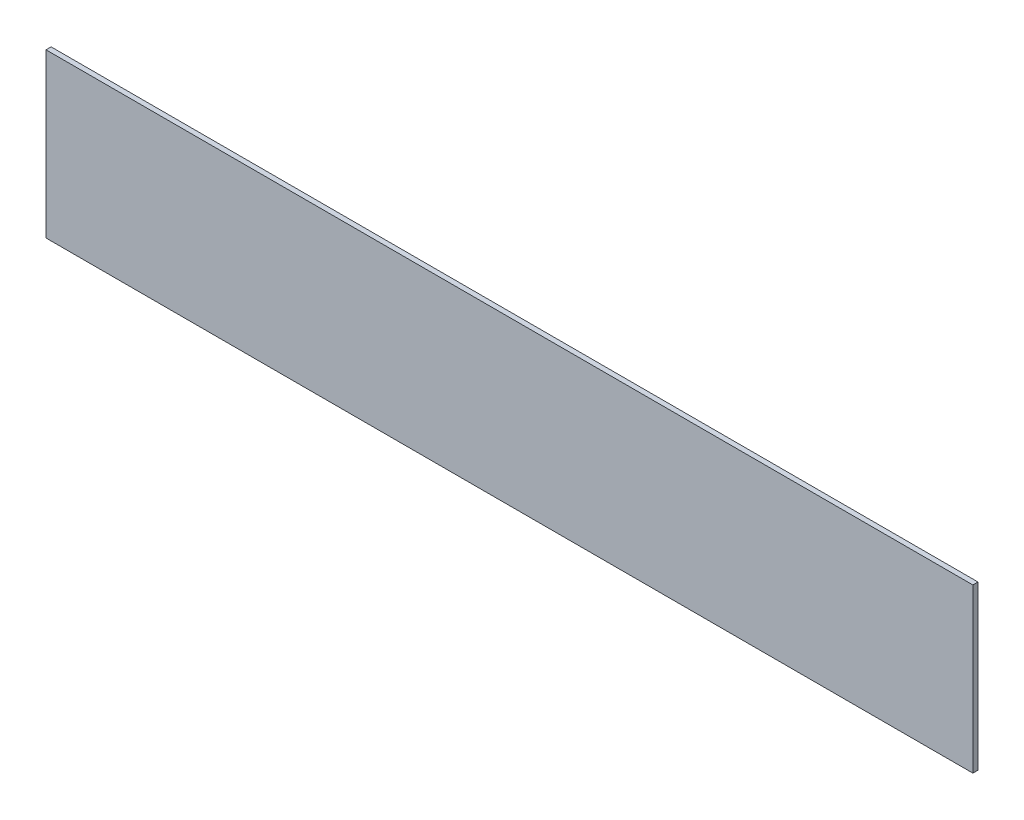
SolidWorks part; units mm, degrees
ref_plane "Front Plane" through (0, 0, 0) normal (0, 0, 1) x (1, 0, 0)
ref_plane "Top Plane" through (0, 0, 0) normal (0, 1, 0) x (1, 0, 0)
ref_plane "Right Plane" through (0, 0, 0) normal (1, 0, 0) x (0, 0, -1)
sketch "Sketch1" plane through (0, 0, 0) normal (0, 0, 1) x (1, 0, 0)
  line L1 (-36.25, 6.375) -> (36.25, 6.375)
  line L2 (-36.25, 6.375) -> (-36.25, -6.375)
  line L3 (-36.25, -6.375) -> (36.25, -6.375)
  line L4 (36.25, 6.375) -> (36.25, -6.375)
  point P4 (0, 6.375)
  point P6 (-36.25, 0)
  dimension "D1" = 72.5
  dimension "D2" = 12.75
extrude "3M VHB" add sketch "Sketch1" along normal blind 0.4
